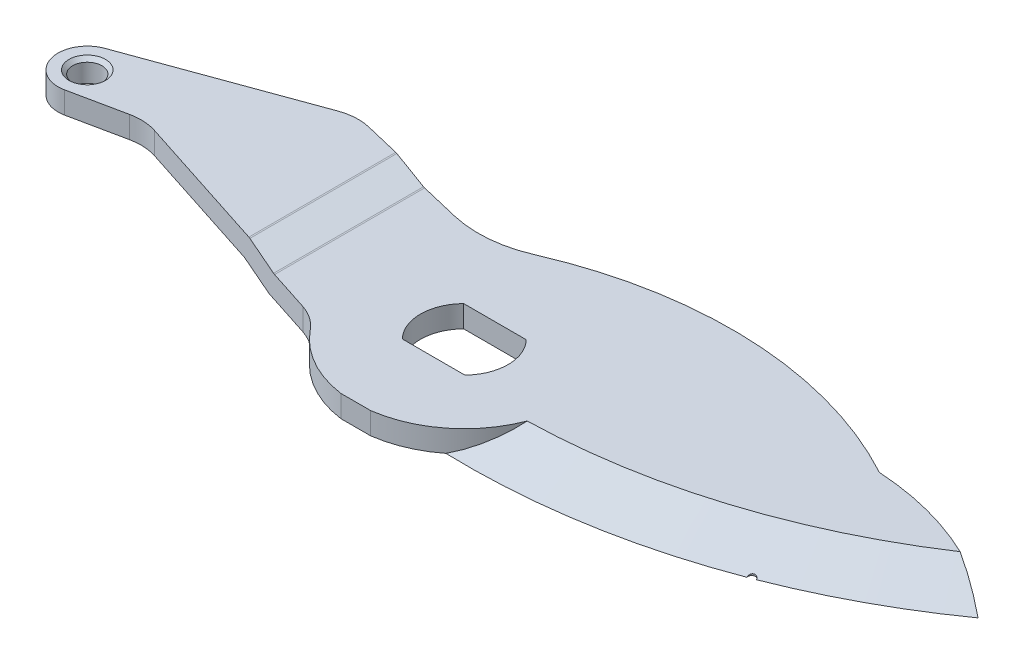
SolidWorks part; units mm, degrees
ref_plane "Plane1" through (0, 0, 0) normal (0, 0, 1) x (1, 0, 0)
ref_plane "Plane2" through (0, 0, 0) normal (0, 1, 0) x (1, 0, 0)
ref_plane "Plane3" through (0, 0, 0) normal (1, 0, 0) x (0, 0, -1)
sketch "Esquisse1" plane through (0, 0, 0) normal (0, 0, 1) x (1, 0, 0)
  line L0 (0, 0) -> (35, 0)
  line L1 (0, 0) -> (0, -3)
  line L3 (0, -3) -> (34, -3)
  line L9 (126, -4) -> (39, -4)
  line L10 (126, -1) -> (126, -4)
  line L11 (40, -1) -> (126, -1)
  line L12 (34, -3) -> (39, -4)
  line L13 (35, 0) -> (40, -1)
  point P6 (0, 0)
extrude "Base-Extrusion" add sketch "Esquisse1" along normal mid plane 40
sketch "Esquisse3" plane through (0, 0, 0) normal (0, 1, 0) x (1, 0, 0)
  line L0 (27.9999, 13.0006) -> (2.6308, 3.7587)
  line L1 (14, -2) -> (4.8167, -3.9154)
  line L2 (48, -13) -> (14, -2)
  line L3 (51, 7.5) -> (27.9999, 13.0006)
  line L4 (126, -20) -> (126, 20) construction
  line L5 (-1, 20) -> (127, 20)
  line L6 (-1, 20) -> (-1, -21)
  line L7 (127, -21) -> (-1, -21)
  line L8 (127, -21) -> (127, 20)
  line L9 (126, 20) -> (39, 20) construction
  arc A2 (4.8167, -3.9154) -> (2.6308, 3.7587) centre (4, 0.0003) cw
  arc A3 (51, 7.5) -> (105, 7.5) centre (78, -42) cw
  arc A4 (105, 7.5) -> (126, 0) centre (102.6644, -32.1897) cw
  arc A5 (48, -13) -> (70.0496, -16.9275) centre (60.7749, -5.1385) ccw
  arc A6 (70.0496, -16.9275) -> (126, 0) centre (72.8146, 74.8634) ccw
  point P10 (105, 7.5)
  point P13 (126, 0)
  point P17 (115.5, 3.75)
  point P19 (70.0496, -16.9275)
  point P22 (98.0248, -8.4638)
extrude "Enlèv. mat.-Extru.2" cut sketch "Esquisse3" against normal blind 6
sketch "Esquisse4" plane through (0, 0, 0) normal (0, 1, 0) x (-1, 0, 0)
  line L0 (-65.0597, 9.3385) -> (-56.49, 9.3385)
  line L1 (-65.0597, 0.9385) -> (-56.49, 0.9385)
  circle A0 centre (-4, -0.0003) radius 2.0003
  arc A1 (-65.0597, 9.3385) -> (-65.0597, 0.9385) centre (-60.7749, 5.1385) ccw
  arc A2 (-56.49, 9.3385) -> (-56.49, 0.9385) centre (-60.7749, 5.1385) cw
  dimension "D1" = 6
  dimension "D2" = 6
  dimension "D3" = 8.4
  dimension "D4" = 4.2
extrude "Enlèv. mat.-Extru.3" cut sketch "Esquisse4" against normal through all
fillet "Congé1" radius 7
fillet "Congé2" radius 7
fillet "Congé3" radius 16
fillet "Congé4" radius 7
chamfer "Chanfrein16" distance 3 angle 65
fillet "Congé5" radius 1
chamfer "Chanfrein17" distance 0.5 angle 45
sketch "Esquisse6" plane through (0, -4, 0) normal (0, -1, 0) x (1, 0, 0)
  circle A0 centre (105.8399, 10.8252) radius 0.5
  arc A1 (126, 0) -> (70.0496, 16.9275) centre (72.8146, -74.8634) ccw construction
extrude "Enlèv. mat.-Extru.4" cut sketch "Esquisse6" against normal through all
